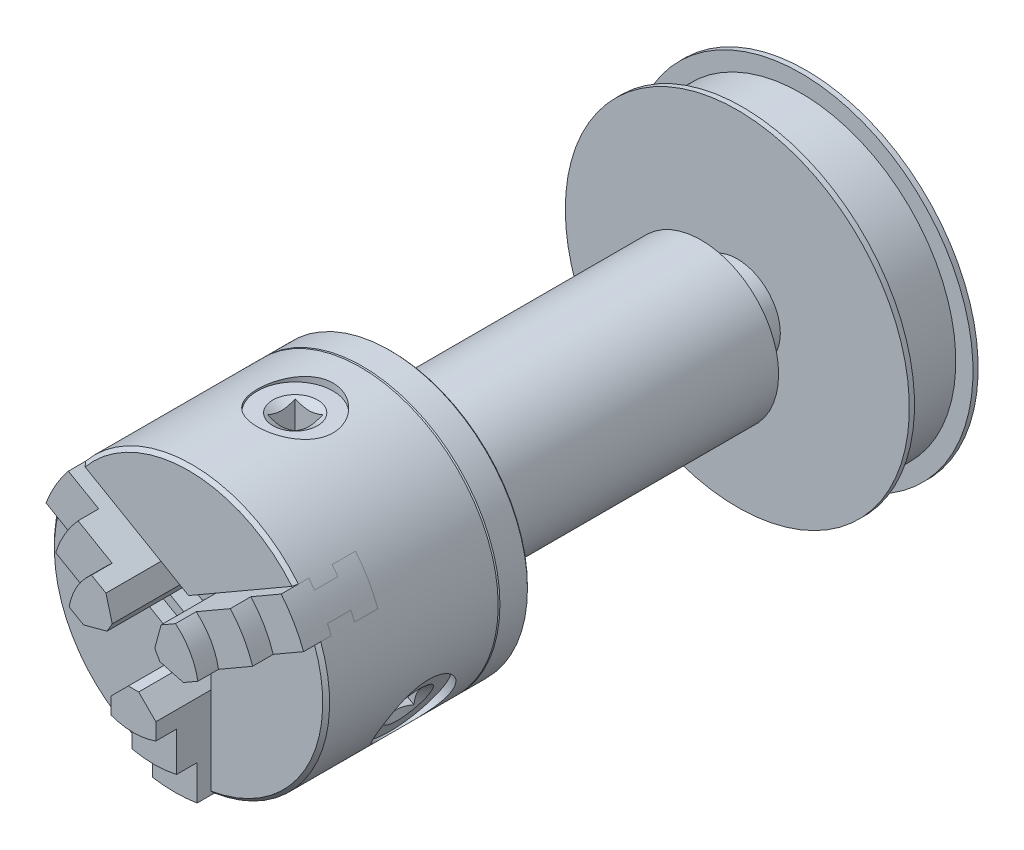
SolidWorks part; units mm, degrees
ref_plane "Front Plane" through (0, 0, 0) normal (0, 0, 1) x (1, 0, 0)
ref_plane "Top Plane" through (0, 0, 0) normal (0, 1, 0) x (1, 0, 0)
ref_plane "Right Plane" through (0, 0, 0) normal (1, 0, 0) x (0, 0, -1)
sketch "Sketch1" plane through (0, 0, 0) normal (0, 0, 1) x (1, 0, 0)
  circle A0 centre (0, 0) radius 22.5
  dimension "D1" = 45
extrude "Boss-Extrude1" add sketch "Sketch1" along normal blind 80
sketch "Sketch2" plane through (0, 0, 0) normal (0, 0, -1) x (-1, 0, 0)
  circle A0 centre (0, 0) radius 12.5
  dimension "D1" = 25
extrude "Boss-Extrude2" add sketch "Sketch2" along normal blind 10.5
sketch "Sketch3" plane through (0, 0, -10.5) normal (0, 0, -1) x (-1, 0, 0)
  circle A0 centre (0, 0) radius 50
  dimension "D1" = 100
extrude "Boss-Extrude3" add sketch "Sketch3" along normal blind 1.5
sketch "Sketch4" plane through (0, 0, -12) normal (0, 0, -1) x (-1, 0, 0)
  circle A0 centre (0, 0) radius 45
  dimension "D1" = 90
extrude "Boss-Extrude4" add sketch "Sketch4" along normal blind 17
sketch "Sketch5" plane through (0, 0, -29) normal (0, 0, -1) x (-1, 0, 0)
  circle A0 centre (0, 0) radius 50
extrude "Boss-Extrude5" add sketch "Sketch5" along normal blind 1.5
sketch "Sketch6" plane through (0, 0, -30.5) normal (0, 0, -1) x (-1, 0, 0)
  circle A0 centre (0, 0) radius 12.5
extrude "Boss-Extrude6" add sketch "Sketch6" along normal blind 1.5 separate body
sketch "Sketch7" plane through (0, 0, -32) normal (0, 0, -1) x (-1, 0, 0)
  circle A0 centre (0, 0) radius 6
extrude "Boss-Extrude7" add sketch "Sketch7" along normal blind 8 separate body
sketch "Sketch8" plane through (0, 0, 80) normal (0, 0, 1) x (1, 0, 0)
  circle A0 centre (0, 0) radius 12.5
extrude "Boss-Extrude8" add sketch "Sketch8" along normal blind 2
sketch "Sketch9" plane through (0, 0, 82) normal (0, 0, 1) x (1, 0, 0)
  circle A0 centre (0, 0) radius 22.5
extrude "Boss-Extrude9" add sketch "Sketch9" along normal blind 8
sketch "Sketch10" plane through (0, 0, 90) normal (0, 0, 1) x (1, 0, 0)
  circle A0 centre (0, 0) radius 40
extrude "Boss-Extrude10" add sketch "Sketch10" along normal blind 9
chamfer "Chamfer1" distance 0.5 angle 45 2 edges at (40, 0, 99) (40, 0, 90)
sketch "Sketch11" plane through (0, 0, 99) normal (0, 0, 1) x (1, 0, 0)
  circle A0 centre (0, 0) radius 40
  dimension "D1" = 80
extrude "Boss-Extrude11" add sketch "Sketch11" along normal blind 50
chamfer "Chamfer2" distance 1 angle 45 1 edges at (40, 0, 149)
sketch "Sketch12" plane through (0, 0, 0) normal (0, 1, 0) x (1, 0, 0)
  line L0 (-39, -149) -> (39, -149) construction
  line L1 (0, 0) -> (0, -162.2804) construction
  circle A0 centre (0, -118) radius 11
  dimension "D1" = 22
  dimension "D2" = 31
extrude "Cut-Extrude1" cut sketch "Sketch12" along normal through all from offset 38
sketch "Sketch13" plane through (0, 38, 0) normal (0, 1, 0) x (1, 0, 0)
  line L1 (-4, -122) -> (4, -122)
  line L2 (-4, -122) -> (-4, -114)
  line L3 (-4, -114) -> (4, -114)
  line L4 (4, -122) -> (4, -114)
  line L5 (-4, -122) -> (4, -114) construction
  line L6 (-4, -114) -> (4, -122) construction
  point P0 (0, -118)
  dimension "D1" = 8
  dimension "D2" = 8
extrude "Cut-Extrude2" cut sketch "Sketch13" against normal blind 13
sketch "Sketch14" plane through (0, 38, 0) normal (0, 1, 0) x (1, 0, 0)
  circle A0 centre (0, -118) radius 6.5
extrude "Cut-Extrude3" cut sketch "Sketch14" against normal through all draft 60
pattern_circular "CirPattern1" count 3 over 360 about axis through (0, 0, 0) along (0, 0, 1) of "Cut-Extrude1", "Cut-Extrude2", "Cut-Extrude3"
sketch "Sketch16" plane through (0, 0, 0) normal (0, 1, 0) x (1, 0, 0)
  line L0 (-39, -149) -> (39, -149) construction
  line L1 (-6.5, -153) -> (-3.7675, -153)
  line L2 (-6.5, -153) -> (-6.5, -145)
  line L3 (-6.5, -145) -> (-3.7675, -145)
  line L4 (6.5, -153) -> (6.5, -145)
  line L5 (3.7675, -138.2) -> (6.5, -138.2)
  line L6 (3.7675, -145) -> (3.7675, -138.2)
  line L7 (3.7675, -153) -> (6.5, -153)
  line L8 (-3.7675, -155.2) -> (3.7675, -155.2)
  line L9 (-3.7675, -155.2) -> (-3.7675, -153)
  line L11 (3.7675, -155.2) -> (3.7675, -153)
  line L14 (-6.5, -138.2) -> (-3.7675, -138.2)
  line L15 (-6.5, -138.2) -> (-6.5, -131.4)
  line L16 (-6.5, -131.4) -> (6.5, -131.4)
  line L17 (6.5, -138.2) -> (6.5, -131.4)
  line L20 (-3.7675, -145) -> (-3.7675, -138.2)
  line L21 (3.7675, -145) -> (6.5, -145)
  point P0 (0, -149)
  point P7 (0, -145)
  dimension "D1" = 13
  dimension "D2" = 13
  dimension "D3" = 6.8
  dimension "D4" = 6.8
  dimension "D5" = 4
extrude "Cut-Extrude4" cut sketch "Sketch16" against normal through all
pattern_circular "CirPattern2" count 3 over 360 about axis through (0, 0, 0) along (0, 0, 1) of "Cut-Extrude4"
sketch "Sketch17" plane through (0, 0, 0) normal (0, 1, 0) x (1, 0, 0)
  line L0 (-6.5, -165) -> (6.5, -165)
  line L16 (-6.5, -153) -> (-3.7675, -153)
  line L17 (-6.5, -145) -> (-6.5, -153)
  line L18 (-3.7675, -145) -> (-6.5, -145)
  line L19 (-3.7675, -138.2) -> (-3.7675, -145)
  line L20 (-6.5, -138.2) -> (-3.7675, -138.2)
  line L21 (-6.5, -131.4) -> (-6.5, -138.2)
  line L22 (6.5, -131.4) -> (-6.5, -131.4)
  line L23 (6.5, -138.2) -> (6.5, -131.4)
  line L24 (3.7675, -138.2) -> (6.5, -138.2)
  line L25 (3.7675, -145) -> (3.7675, -138.2)
  line L26 (6.5, -145) -> (3.7675, -145)
  line L27 (6.5, -153) -> (6.5, -145)
  line L28 (3.7675, -153) -> (6.5, -153)
  line L29 (3.7675, -155.2) -> (3.7675, -153)
  line L30 (-3.7675, -155.2) -> (3.7675, -155.2)
  line L31 (-3.7675, -153) -> (-3.7675, -155.2)
  line L33 (-6.5, -145) -> (-6.5, -165)
  line L34 (-3.7675, -145) -> (-6.5, -145)
  line L35 (-3.7675, -138.2) -> (-3.7675, -145)
  line L36 (-6.5, -138.2) -> (-3.7675, -138.2)
  line L37 (-6.5, -131.4) -> (-6.5, -138.2)
  line L38 (6.5, -131.4) -> (-6.5, -131.4)
  line L39 (6.5, -138.2) -> (6.5, -131.4)
  line L40 (3.7675, -138.2) -> (6.5, -138.2)
  line L41 (3.7675, -145) -> (3.7675, -138.2)
  line L42 (6.5, -145) -> (3.7675, -145)
  line L43 (6.5, -165) -> (6.5, -145)
  line L48 (-6.5, -153) -> (-3.7675, -153)
  line L49 (-6.5, -145) -> (-6.5, -153)
  line L50 (-3.7675, -145) -> (-6.5, -145)
  line L51 (-3.7675, -138.2) -> (-3.7675, -145)
  line L52 (-6.5, -138.2) -> (-3.7675, -138.2)
  line L53 (-6.5, -131.4) -> (-6.5, -138.2)
  line L54 (6.5, -131.4) -> (-6.5, -131.4)
  line L55 (6.5, -138.2) -> (6.5, -131.4)
  line L56 (3.7675, -138.2) -> (6.5, -138.2)
  line L57 (3.7675, -145) -> (3.7675, -138.2)
  line L58 (6.5, -145) -> (3.7675, -145)
  line L59 (6.5, -153) -> (6.5, -145)
  line L60 (3.7675, -153) -> (6.5, -153)
  line L61 (3.7675, -155.2) -> (3.7675, -153)
  line L62 (-3.7675, -155.2) -> (3.7675, -155.2)
  line L63 (-3.7675, -153) -> (-3.7675, -155.2)
  line L65 (-6.5, -145) -> (-6.5, -165)
  line L66 (-3.7675, -145) -> (-6.5, -145)
  line L67 (-3.7675, -138.2) -> (-3.7675, -145)
  line L68 (-6.5, -138.2) -> (-3.7675, -138.2)
  line L69 (-6.5, -131.4) -> (-6.5, -138.2)
  line L70 (6.5, -131.4) -> (-6.5, -131.4)
  line L71 (6.5, -138.2) -> (6.5, -131.4)
  line L72 (3.7675, -138.2) -> (6.5, -138.2)
  line L73 (3.7675, -145) -> (3.7675, -138.2)
  line L74 (6.5, -145) -> (3.7675, -145)
  line L75 (6.5, -165) -> (6.5, -145)
  dimension "D3" = 20
  dimension "D1" = 0
  dimension "D2" = 0
extrude "Boss-Extrude12" add sketch "Sketch17" against normal blind 32 from offset 8 separate body contours L0 L43 L42 L41 L40 L39 L38 L37 L36 L35 L34 L33
chamfer "Chamfer3" distance 5 angle 45 2 edges at (-6.5, -8, 155) (6.5, -8, 155)
sketch "Sketch18" plane through (0, 0, 165) normal (0, 0, 1) x (1, 0, 0)
  circle A0 centre (0, 0) radius 19
  circle A1 centre (0, 0) radius 56.9622
  dimension "D1" = 38
sketch "Sketch19" plane through (0, 0, 131.4) normal (0, 0, 1) x (1, 0, 0)
pattern_circular "CirPattern6" count 3 over 360 about axis through (0, 0, 0) along (0, 0, 1)
extrude "Cut-Extrude5" cut sketch "Sketch18" against normal blind 6
sketch "Sketch20" plane through (0, 0, 159) normal (0, 0, 1) x (1, 0, 0)
  circle A0 centre (0, 0) radius 30
  arc A1 (-6.5, -17.8536) -> (6.5, -17.8536) centre (0, 0) ccw construction
  circle A3 centre (0, 0) radius 66.1427
  point P3 (0, -19)
  dimension "D1" = 11
extrude "Cut-Extrude6" cut sketch "Sketch20" against normal blind 6
sketch "Sketch21" plane through (0, 0, 153) normal (0, 0, 1) x (1, 0, 0)
  circle A0 centre (0, 0) radius 40
  circle A1 centre (0, 0) radius 72.1473
extrude "Cut-Extrude7" cut sketch "Sketch21" against normal blind 25
